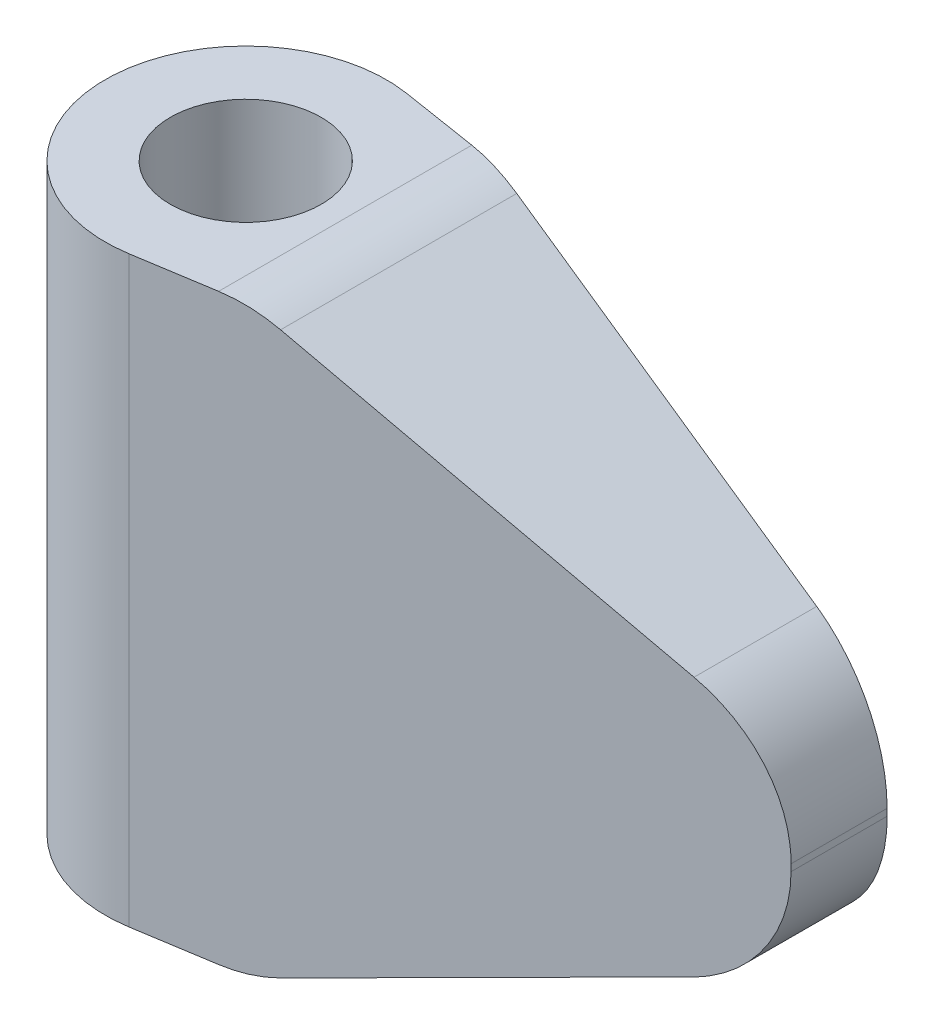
SolidWorks part; units mm, degrees
ref_plane "Plan de face" through (0, 0, 0) normal (0, 0, 1) x (1, 0, 0)
ref_plane "Plan de dessus" through (0, 0, 0) normal (0, 1, 0) x (1, 0, 0)
ref_plane "Plan de coté" through (0, 0, 0) normal (1, 0, 0) x (0, 0, -1)
sketch "Esquisse1" plane through (0, 0, 0) normal (0, 1, 0) x (1, 0, 0)
  line L0 (0, 0) -> (41.7264, 0) construction
  line L1 (3.22, 20.2455) -> (86.5, 7)
  line L2 (3.22, -20.2455) -> (86.5, -7)
  line L3 (86.5, 7) -> (86.5, -7)
  arc A0 (3.22, 20.2455) -> (3.22, -20.2455) centre (0, 0) ccw
  circle A1 centre (0, 0) radius 11
  point P7 (86.5, 0)
  dimension "D1" = 20.5
  dimension "D2" = 107
  dimension "D4" = 22
  dimension "D3" = 14
extrude "Boss.-Extru.1" add sketch "Esquisse1" along normal mid plane 85
sketch "Esquisse2" plane through (0, 0, 0) normal (0, 0, 1) x (1, 0, 0)
  line L0 (22.2928, 40.9193) -> (74.2928, 18.9193)
  line L1 (14.5, 42.5) -> (86.5, 42.5)
  line L2 (3.22, 42.5) -> (86.5, 42.5) construction
  line L3 (86.5, 42.5) -> (86.5, 0.5)
  line L4 (86.5, 42.5) -> (86.5, -42.5) construction
  line L5 (-20.5, 42.5) -> (-20.5, -42.5) construction
  line L6 (0, 0) -> (57.9084, 0) construction
  line L7 (86.5, -42.5) -> (14.5, -42.5)
  line L8 (3.22, -42.5) -> (86.5, -42.5) construction
  line L9 (86.5, -42.5) -> (86.5, -0.5)
  line L10 (22.2928, -40.9193) -> (74.2928, -18.9193)
  arc A0 (74.2928, 18.9193) -> (86.5, 0.5) centre (66.5, 0.5) cw
  arc A1 (14.5, 42.5) -> (22.2928, 40.9193) centre (14.5, 22.5) cw
  arc A2 (74.2928, -18.9193) -> (86.5, -0.5) centre (66.5, -0.5) ccw
  arc A3 (22.2928, -40.9193) -> (14.5, -42.5) centre (14.5, -22.5) cw
  dimension "D1" = 20
  dimension "D2" = 42
  dimension "D3" = 35
extrude "Enlèv. mat.-Extru.1" cut sketch "Esquisse2" against normal through all both and the other way through all
